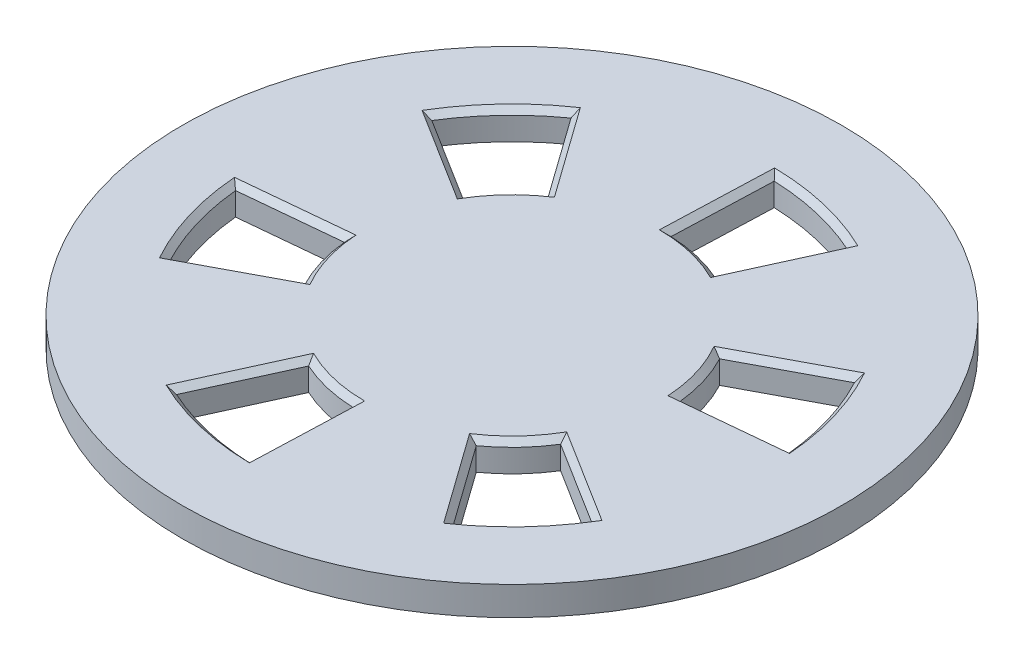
SolidWorks part; units mm, degrees
ref_plane "Front Plane" through (0, 0, 0) normal (0, 0, 1) x (1, 0, 0)
ref_plane "Top Plane" through (0, 0, 0) normal (0, 1, 0) x (1, 0, 0)
ref_plane "Right Plane" through (0, 0, 0) normal (1, 0, 0) x (0, 0, -1)
sketch "Sketch1" plane through (0, 0, 0) normal (0, 1, 0) x (1, 0, 0)
  circle A0 centre (0, 0) radius 145.6162
extrude "Extrude1" add sketch "Sketch1" along normal blind 12.7
sketch "Sketch2" plane through (0, 12.7, 0) normal (0, 1, 0) x (-1, 0, 0)
  line L0 (-98.8713, -52.4317) -> (-59.9427, -31.7878)
  line L1 (-67.5351, -6.5263) -> (-111.3945, -10.7646)
  arc A0 (-111.3945, -10.7646) -> (-98.8713, -52.4317) centre (0, 0) ccw
  arc A1 (-67.5351, -6.5263) -> (-59.9427, -31.7878) centre (0, 0) ccw
extrude "Cut-Extrude1" cut sketch "Sketch2" against normal through all
chamfer "Chamfer1" distance 2.54 angle 45 4 edges at (107.1772, 12.7, -32.2126) (79.407, 12.7, -42.1098) (64.9783, 12.7, -19.5295) (89.4648, 12.7, -8.6454)
pattern_circular "CirPattern1" count 6 over 360 about axis through (0, 0, 0) along (0, 1, 0) of "Cut-Extrude1", "Chamfer1"
sketch "Sketch3" plane through (0, 12.7, 0) normal (0, 1, 0) x (-1, 0, 0)
  line L0 (-98.8713, -52.4317) -> (-59.9427, -31.7878) construction
  line L1 (-67.5351, -6.5263) -> (-111.3945, -10.7646) construction
  line L2 (-98.8713, -52.4317) -> (-59.9427, -31.7878)
  line L3 (-67.5351, -6.5263) -> (-111.3945, -10.7646)
  arc A0 (-67.5351, -6.5263) -> (-59.9427, -31.7878) centre (0, 0) ccw construction
  arc A1 (-111.3945, -10.7646) -> (-98.8713, -52.4317) centre (0, 0) ccw construction
  arc A2 (-67.5351, -6.5263) -> (-59.9427, -31.7878) centre (0, 0) ccw
  arc A3 (-111.3945, -10.7646) -> (-98.8713, -52.4317) centre (0, 0) ccw
